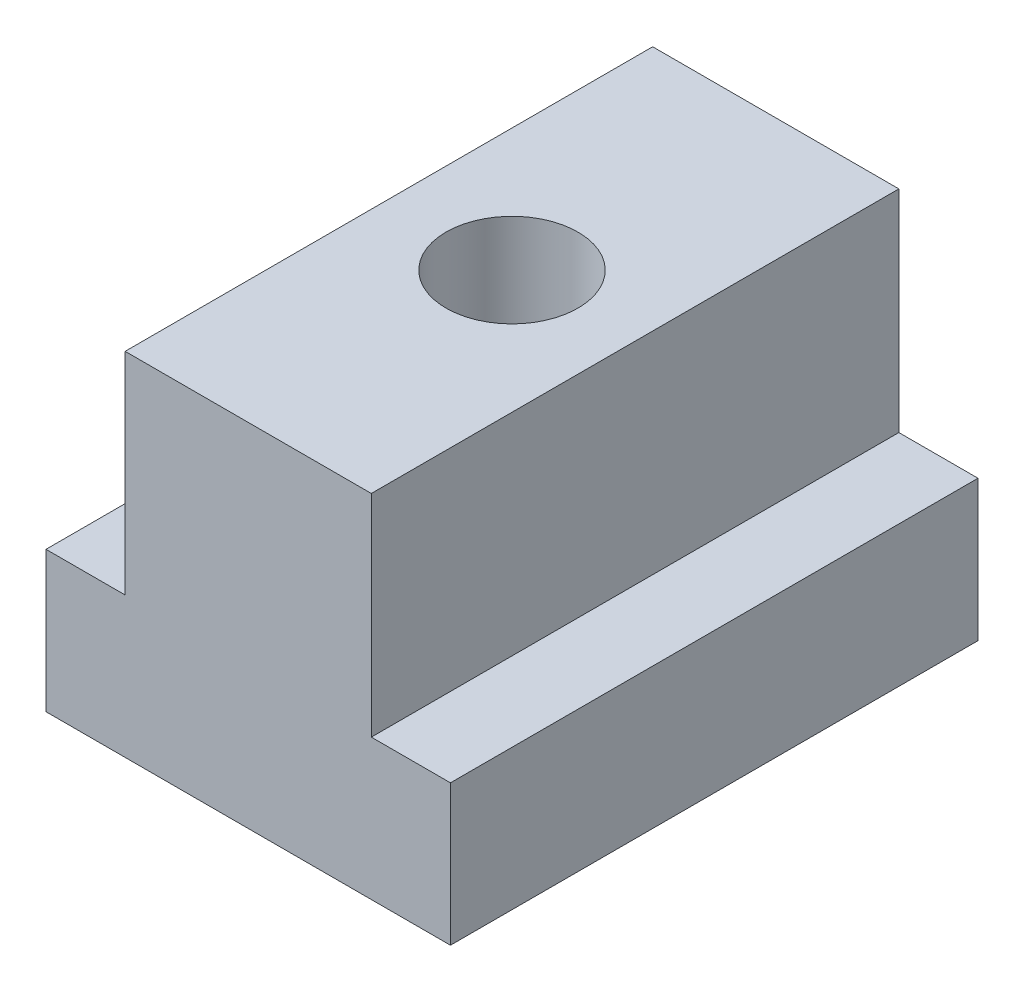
SolidWorks part; units mm, degrees
ref_plane "Face" through (0, 0, 0) normal (0, 0, 1) x (1, 0, 0)
ref_plane "Dessus" through (0, 0, 0) normal (0, 1, 0) x (1, 0, 0)
ref_plane "Droite" through (0, 0, 0) normal (1, 0, 0) x (0, 0, -1)
sketch "Esquisse1" plane through (0, 0, 0) normal (0, 0, 1) x (1, 0, 0)
  line L0 (-11.5, 0) -> (11.5, 0)
  line L1 (11.5, 0) -> (11.5, 8)
  line L2 (11.5, 8) -> (7, 8)
  line L3 (7, 8) -> (7, 20)
  line L4 (7, 20) -> (-7, 20)
  line L5 (-7, 8) -> (-7, 20)
  line L6 (-11.5, 8) -> (-7, 8)
  line L7 (-11.5, 0) -> (-11.5, 8)
  line L8 (0, 0) -> (0, 75.9225) construction
  point P8 (0, 20)
  dimension "D1" = 23
  dimension "D2" = 14
  dimension "D3" = 8
  dimension "D4" = 12
extrude "Extrusion1" add sketch "Esquisse1" along normal mid plane 30
sketch "Esquisse2" plane through (0, 20, 0) normal (0, 1, 0) x (1, 0, 0)
  circle A0 centre (0, 0) radius 3.75
  dimension "D1" = 7.5
extrude "Enlèv. mat.-Extru.1" cut sketch "Esquisse2" against normal through all
